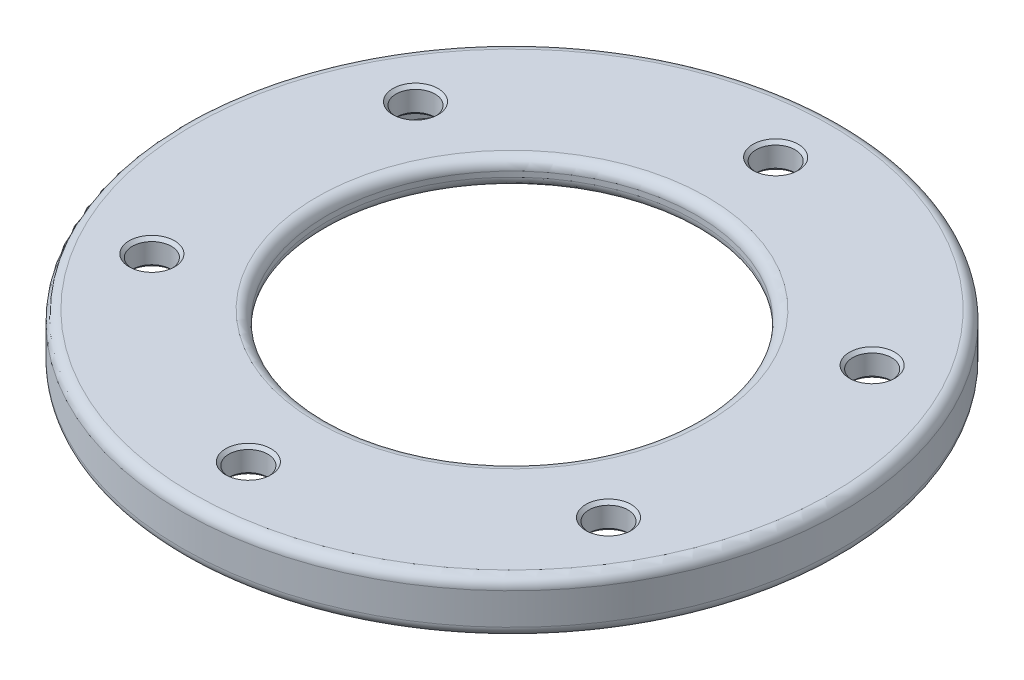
SolidWorks part; units mm, degrees
ref_plane "Front" through (0, 0, 0) normal (0, 0, 1) x (1, 0, 0)
ref_plane "Top" through (0, 0, 0) normal (0, 1, 0) x (1, 0, 0)
ref_plane "Right" through (0, 0, 0) normal (1, 0, 0) x (0, 0, -1)
sketch "Sketch1" plane through (0, 0, 0) normal (0, 1, 0) x (1, 0, 0)
  circle A0 centre (0, 0) radius 22.225
  circle A1 centre (0, 0) radius 39.6875
  dimension "D1" = 44.45
  dimension "D2" = 79.375
extrude "Boss-Extrude1" add sketch "Sketch1" along normal blind 3.175
sketch "Sketch2" plane through (0, 0, 0) normal (0, -1, 0) x (1, 0, 0)
  circle A0 centre (0, 0) radius 39.6875
  circle A1 centre (0, 0) radius 37.9095
  dimension "D1" = 75.819
extrude "Boss-Extrude2" add sketch "Sketch2" along normal blind 3.175
hole_wizard "#13 (0.185) Diameter Hole1" positions "Sketch3" profile "Sketch4" hole size "#13" standard "ANSI Inch"
sketch "Sketch3" plane through (0, 3.175, 0) normal (0, 1, 0) x (1, 0, 0)
  point P0 (0, 31.75)
  point P8 (27.4963, 15.875)
  point P9 (27.4963, -15.875)
  point P10 (0, -31.75)
  point P11 (-27.4963, -15.875)
  point P12 (-27.4963, 15.875)
  dimension "D1" = 31.75
  dimension "D2" = 6
sketch "Sketch4" plane through (0, 3.175, -31.75) normal (1, 0, 0) x (0, 0, 1)
  line L0 (0, 0) -> (0, 3.175)
  line L1 (0, 3.175) -> (2.7305, 3.175)
  line L2 (2.3495, 2.794) -> (2.3495, 0.381)
  line L3 (2.3495, 0.381) -> (2.7305, 0)
  line L5 (2.7305, 0) -> (0, 0)
  line L6 (-2.3495, 0.381) -> (-2.7305, 0) construction
  line L7 (2.7305, 3.175) -> (2.3495, 2.794)
  line L8 (-2.7305, 3.175) -> (-2.3495, 2.794) construction
  line L11 (0, -6.35) -> (0, 107.95) construction
  dimension "Thru Hole Dia." = 4.699
  dimension "Thru Hole Depth" = 3.175
  dimension "Near C'Sink Dia." = 5.461
  dimension "Near C'Sink Angle" = 90
  dimension "Far C'Sink Dia." = 5.461
  dimension "Far C'Sink Angle" = 90
fillet "Fillet1" radius 1.27 4 edges at (0, -3.175, -39.6875) (0, 3.175, 39.6875) (0, 0, 22.225) (0, 3.175, 22.225)
